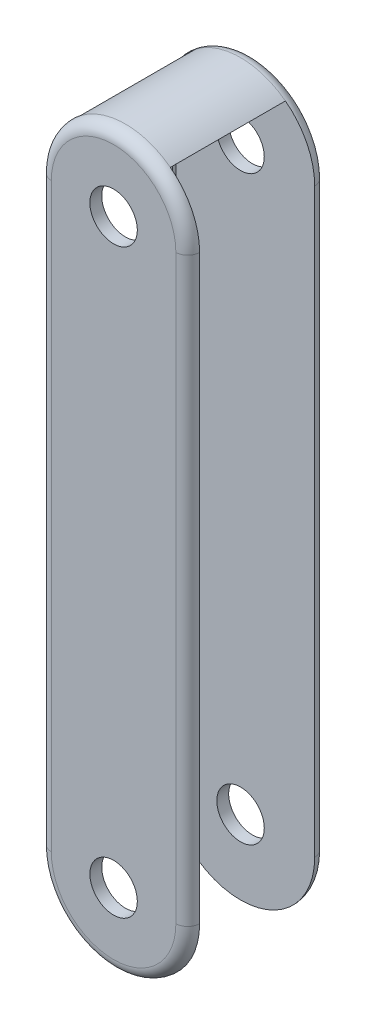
SolidWorks part; units mm, degrees
ref_plane "Face" through (0, 0, 0) normal (0, 0, 1) x (1, 0, 0)
ref_plane "Dessus" through (0, 0, 0) normal (0, 1, 0) x (1, 0, 0)
ref_plane "Droite" through (0, 0, 0) normal (1, 0, 0) x (0, 0, -1)
sketch "Esquisse1" plane through (0, 0, 0) normal (0, 0, 1) x (1, 0, 0)
  line L0 (0, 0) -> (0, 49)
  line L2 (12.5, 49) -> (12.5, 0)
  arc A0 (12.5, 0) -> (0, 0) centre (6.25, 0) cw
  arc A1 (12.5, 49) -> (0, 49) centre (6.25, 49) ccw
  dimension "D1" = 12.5
  dimension "D2" = 49
extrude "Base-Extrusion" add sketch "Esquisse1" along normal blind 11.7
fillet "Congé1" radius 1 4 edges at (6.25, 55.25, 11.7) (0, 24.5, 11.7) (6.25, -6.25, 11.7) (12.5, 24.5, 11.7)
fillet "Congé2" radius 1 4 edges at (0, 24.5, 0) (6.25, 55.25, 0) (12.5, 24.5, 0) (6.25, -6.25, 0)
sketch "Esquisse2" plane through (12.5, 0, 0) normal (1, 0, 0) x (0, 0, -1)
  line L0 (-1, -11.1264) -> (-1, 53.9745)
  line L1 (-1, 53.9745) -> (-10.7, 53.9745)
  line L2 (-10.7, 53.9745) -> (-10.7, -11.1264)
  line L3 (-10.7, -11.1264) -> (-1, -11.1264)
  line L4 (-11.7, 0) -> (-11.7, 49) construction
  line L5 (0, 49) -> (0, 0) construction
  dimension "D1" = 1
  dimension "D2" = 1
extrude "Enlèv. mat.-Extru.1" cut sketch "Esquisse2" against normal blind 11.7
sketch "Esquisse3" plane through (0, 0, 0) normal (-1, 0, 0) x (0, 0, 1)
  line L0 (1.3, 49.948) -> (1.3, 15.15)
  line L1 (11.7, 49) -> (11.7, 0) construction
  line L3 (10.7, 0) -> (10.7, 49) construction
  line L4 (10.7, 0) -> (10.7, -6.25) construction
  line L5 (1, 49) -> (1, 0) construction
  line L7 (9.3, 15.15) -> (9.3, 49.948)
  line L8 (10.7, -6.25) -> (10.7, 3.55)
  line L9 (10.7, 3.55) -> (1, 3.55)
  line L10 (1, 3.55) -> (1, -6.25)
  line L11 (1, -6.25) -> (1, 0) construction
  line L12 (1, -6.25) -> (10.7, -6.25)
  line L13 (9.3, 49.948) -> (1.3, 49.948)
  arc A0 (9.3, 15.15) -> (1.3, 15.15) centre (5.3, 15.15) cw
  dimension "D2" = 4
  dimension "D1" = 9.8
  dimension "D3" = 11.6
  dimension "D4" = 2.4
extrude "Enlèv. mat.-Extru.3" cut sketch "Esquisse3" against normal blind 11.7
sketch "Esquisse4" plane through (0, 0, 11.7) normal (0, 0, 1) x (1, 0, 0)
  circle A0 centre (6.25, 0) radius 2
  circle A1 centre (6.25, 49) radius 2
  arc A2 (11.5, 49) -> (1, 49) centre (6.25, 49) ccw construction
  arc A3 (1, 0) -> (11.5, 0) centre (6.25, 0) ccw construction
  dimension "D1" = 4
  dimension "D2" = 4
extrude "Enlèv. mat.-Extru.4" cut sketch "Esquisse4" against normal through all
